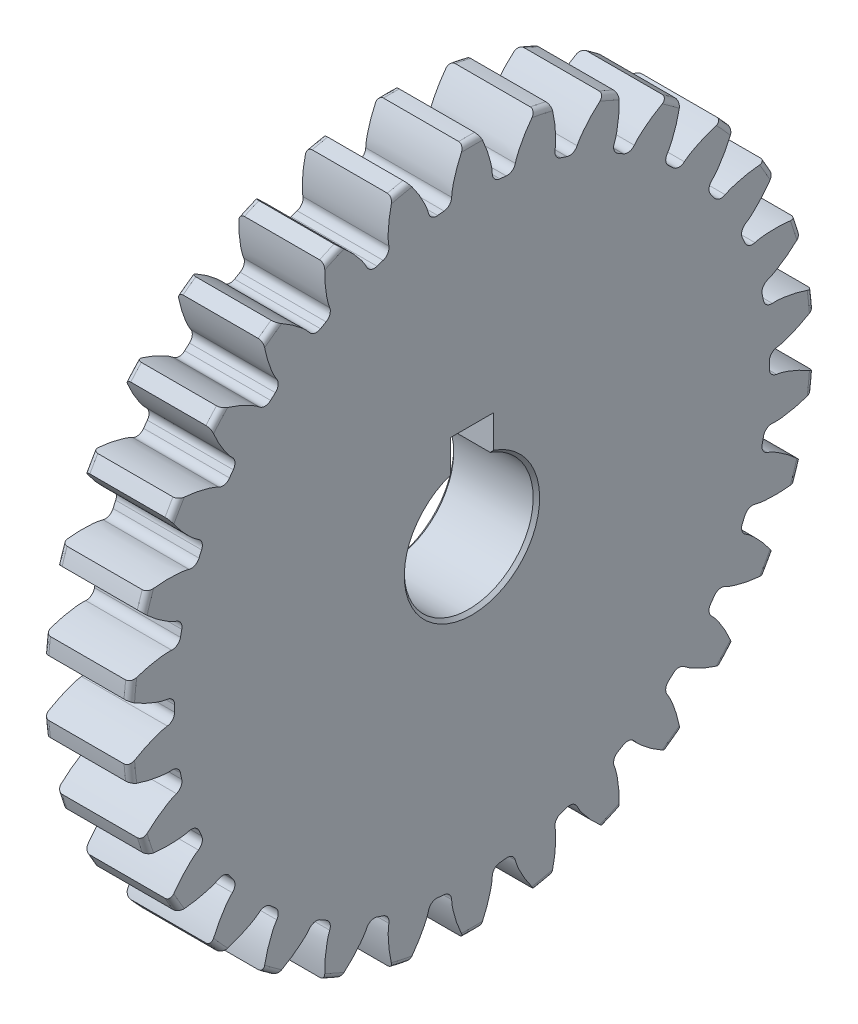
SolidWorks part; units mm, degrees
ref_plane "Front Plane" through (0, 0, 0) normal (0, 0, 1) x (1, 0, 0)
ref_plane "Top Plane" through (0, 0, 0) normal (0, 1, 0) x (1, 0, 0)
ref_plane "Right Plane" through (0, 0, 0) normal (1, 0, 0) x (0, 0, -1)
sketch "Sketch1" plane through (0, 0, 0) normal (0, 0, 1) x (1, 0, 0)
  line L0 (-4.5, 16) -> (-4.5, 0)
  line L1 (-4.5, 0) -> (4.5, 0)
  line L2 (4.5, 0) -> (4.5, 16)
  line L3 (4.5, 16) -> (-4.5, 16)
  line L4 (-4.5, 0) -> (4.5, 0) construction
revolve "Revolve1" add sketch "Sketch1" angle 360 about L4
sketch "Sketch2" plane through (-4.5, 0, 0) normal (-1, 0, 0) x (0, 0, 1)
  arc A0 (0.9541, 13.8101) -> (1.9381, 13.7067) centre (0, 0) cw
  arc A1 (2.9651, 15.7229) -> (0.3687, 15.9958) centre (0, 0) ccw
  spline S0 degree 3 poles (0.3687, 15.9958) (0.4111, 15.912) (0.4521, 15.8276) (0.4915, 15.7423) (0.5615, 15.5907) (0.6264, 15.4366) (0.6838, 15.2798) (0.7414, 15.123) (0.7918, 14.9633) (0.8344, 14.8018) (0.89, 14.5911) (0.9382, 14.3754) (0.9452, 14.1576) (0.949, 14.0418) (0.9511, 13.9259) (0.9541, 13.8101) knots -0.000282 -0.000282 -0.000282 -0.000282 0 0 0 0.000501 0.000501 0.000501 0.001002 0.001002 0.001002 0.001658 0.001658 0.001658 0.002003 0.002003 0.002003 0.002003
  spline S1 degree 3 poles (1.9381, 13.7067) (1.965, 13.8194) (1.9912, 13.9322) (2.019, 14.0447) (2.0592, 14.2078) (2.1235, 14.365) (2.1953, 14.5168) (2.2668, 14.6678) (2.3448, 14.8159) (2.4297, 14.9597) (2.5401, 15.1466) (2.6623, 15.3267) (2.7923, 15.5005) (2.8485, 15.5757) (2.9062, 15.6498) (2.9651, 15.7229) knots -0.000345 -0.000345 -0.000345 -0.000345 0 0 0 0.000504 0.000504 0.000504 0.001004 0.001004 0.001004 0.001654 0.001654 0.001654 0.001934 0.001934 0.001934 0.001934
extrude "Cut-Extrude1" cut sketch "Sketch2" against normal through all
sketch "Sketch3" plane through (-4.5, 0, 0) normal (-1, 0, 0) x (0, 0, 1)
  arc A0 (3.8045, 13.3099) -> (4.7455, 13.0042) centre (0, 0) cw
  arc A1 (6.1693, 14.7628) -> (3.6863, 15.5696) centre (0, 0) ccw
  spline S0 degree 3 poles (3.6863, 15.5696) (3.7104, 15.4788) (3.733, 15.3877) (3.7537, 15.2961) (3.7907, 15.1333) (3.8221, 14.969) (3.8457, 14.8037) (3.8694, 14.6384) (3.8856, 14.4717) (3.8937, 14.3049) (3.9042, 14.0872) (3.9065, 13.8662) (3.8681, 13.6517) (3.8477, 13.5376) (3.8257, 13.4239) (3.8045, 13.3099) knots -0.000282 -0.000282 -0.000282 -0.000282 0 0 0 0.000501 0.000501 0.000501 0.001002 0.001002 0.001002 0.001658 0.001658 0.001658 0.002003 0.002003 0.002003 0.002003
  spline S1 degree 3 poles (4.7455, 13.0042) (4.7953, 13.1088) (4.8444, 13.2138) (4.8949, 13.3181) (4.9682, 13.4692) (5.0637, 13.6096) (5.1656, 13.7432) (5.2668, 13.876) (5.374, 14.0046) (5.4869, 14.1276) (5.6337, 14.2875) (5.7907, 14.4382) (5.954, 14.5812) (6.0246, 14.6431) (6.0964, 14.7036) (6.1693, 14.7628) knots -0.000345 -0.000345 -0.000345 -0.000345 0 0 0 0.000504 0.000504 0.000504 0.001004 0.001004 0.001004 0.001654 0.001654 0.001654 0.001934 0.001934 0.001934 0.001934
extrude "Cut-Extrude2" cut sketch "Sketch3" against normal through all
sketch "Sketch4" plane through (-4.5, 0, 0) normal (-1, 0, 0) x (0, 0, 1)
  arc A0 (6.4886, 12.2281) -> (7.3455, 11.7334) centre (0, 0) cw
  arc A1 (9.1038, 13.1575) -> (6.8429, 14.4629) centre (0, 0) ccw
  spline S0 degree 3 poles (6.8429, 14.4629) (6.8476, 14.3691) (6.8507, 14.2753) (6.852, 14.1814) (6.8542, 14.0145) (6.8508, 13.8472) (6.8396, 13.6806) (6.8283, 13.514) (6.8095, 13.3476) (6.7827, 13.1828) (6.7478, 12.9677) (6.704, 12.751) (6.6219, 12.5492) (6.5782, 12.4418) (6.5331, 12.3351) (6.4886, 12.2281) knots -0.000282 -0.000282 -0.000282 -0.000282 0 0 0 0.000501 0.000501 0.000501 0.001002 0.001002 0.001002 0.001658 0.001658 0.001658 0.002003 0.002003 0.002003 0.002003
  spline S1 degree 3 poles (7.3455, 11.7334) (7.416, 11.8254) (7.4858, 11.9178) (7.5569, 12.0093) (7.66, 12.142) (7.7827, 12.2594) (7.9101, 12.3689) (8.0367, 12.4777) (8.1682, 12.5813) (8.3043, 12.6781) (8.4812, 12.8039) (8.6661, 12.9188) (8.8555, 13.0247) (8.9374, 13.0705) (9.0203, 13.1147) (9.1038, 13.1575) knots -0.000345 -0.000345 -0.000345 -0.000345 0 0 0 0.000504 0.000504 0.000504 0.001004 0.001004 0.001004 0.001654 0.001654 0.001654 0.001934 0.001934 0.001934 0.001934
extrude "Cut-Extrude3" cut sketch "Sketch4" against normal through all
sketch "Sketch5" plane through (-4.5, 0, 0) normal (-1, 0, 0) x (0, 0, 1)
  arc A0 (8.8892, 10.6118) -> (9.6245, 9.9498) centre (0, 0) cw
  arc A1 (11.6405, 10.9772) -> (9.7003, 12.7241) centre (0, 0) ccw
  spline S0 degree 3 poles (9.7003, 12.7241) (9.6854, 12.6315) (9.669, 12.539) (9.6507, 12.4469) (9.6182, 12.2831) (9.5801, 12.1203) (9.5345, 11.9597) (9.4888, 11.799) (9.4358, 11.6402) (9.3754, 11.4845) (9.2965, 11.2813) (9.2086, 11.0785) (9.0863, 10.8981) (9.0213, 10.8022) (8.9549, 10.7072) (8.8892, 10.6118) knots -0.000282 -0.000282 -0.000282 -0.000282 0 0 0 0.000501 0.000501 0.000501 0.001002 0.001002 0.001002 0.001658 0.001658 0.001658 0.002003 0.002003 0.002003 0.002003
  spline S1 degree 3 poles (9.6245, 9.9498) (9.7125, 10.0251) (9.8001, 10.101) (9.8887, 10.1757) (10.0171, 10.284) (10.1615, 10.3733) (10.3088, 10.454) (10.4554, 10.5341) (10.6055, 10.6081) (10.7588, 10.6745) (10.9579, 10.7608) (11.1627, 10.8347) (11.37, 10.8989) (11.4596, 10.9267) (11.5499, 10.9527) (11.6405, 10.9772) knots -0.000345 -0.000345 -0.000345 -0.000345 0 0 0 0.000504 0.000504 0.000504 0.001004 0.001004 0.001004 0.001654 0.001654 0.001654 0.001934 0.001934 0.001934 0.001934
extrude "Cut-Extrude4" cut sketch "Sketch5" against normal through all
sketch "Sketch6" plane through (-4.5, 0, 0) normal (-1, 0, 0) x (0, 0, 1)
  arc A0 (10.9013, 8.5317) -> (11.4829, 7.7313) centre (0, 0) cw
  arc A1 (13.6684, 8.3172) -> (12.1338, 10.4293) centre (0, 0) ccw
  spline S0 degree 3 poles (12.1338, 10.4293) (12.1, 10.3417) (12.0647, 10.2547) (12.0277, 10.1684) (11.9619, 10.015) (11.8907, 9.8636) (11.8127, 9.716) (11.7346, 9.5683) (11.6498, 9.424) (11.5582, 9.2843) (11.4389, 9.102) (11.3107, 8.9218) (11.1536, 8.7708) (11.0701, 8.6906) (10.9854, 8.6114) (10.9013, 8.5317) knots -0.000282 -0.000282 -0.000282 -0.000282 0 0 0 0.000501 0.000501 0.000501 0.001002 0.001002 0.001002 0.001658 0.001658 0.001658 0.002003 0.002003 0.002003 0.002003
  spline S1 degree 3 poles (11.4829, 7.7313) (11.5846, 7.7867) (11.6861, 7.8427) (11.7882, 7.8974) (11.9364, 7.9766) (12.0962, 8.034) (12.2571, 8.0822) (12.4171, 8.1301) (12.5793, 8.1712) (12.743, 8.2043) (12.9558, 8.2474) (13.1714, 8.2771) (13.3875, 8.2968) (13.481, 8.3053) (13.5747, 8.312) (13.6684, 8.3172) knots -0.000345 -0.000345 -0.000345 -0.000345 0 0 0 0.000504 0.000504 0.000504 0.001004 0.001004 0.001004 0.001654 0.001654 0.001654 0.001934 0.001934 0.001934 0.001934
extrude "Cut-Extrude5" cut sketch "Sketch6" against normal through all
sketch "Sketch7" plane through (-4.5, 0, 0) normal (-1, 0, 0) x (0, 0, 1)
  arc A0 (12.4369, 6.0788) -> (12.8394, 5.1749) centre (0, 0) cw
  arc A1 (15.0989, 5.2936) -> (14.0371, 7.6786) centre (0, 0) ccw
  spline S0 degree 3 poles (14.0371, 7.6786) (13.9858, 7.6) (13.9331, 7.5222) (13.879, 7.4455) (13.7827, 7.3091) (13.6816, 7.1758) (13.5746, 7.0477) (13.4675, 6.9195) (13.3545, 6.7959) (13.236, 6.6783) (13.0813, 6.5248) (12.9185, 6.3752) (12.7335, 6.2602) (12.635, 6.199) (12.5358, 6.1392) (12.4369, 6.0788) knots -0.000282 -0.000282 -0.000282 -0.000282 0 0 0 0.000501 0.000501 0.000501 0.001002 0.001002 0.001002 0.001658 0.001658 0.001658 0.002003 0.002003 0.002003 0.002003
  spline S1 degree 3 poles (12.8394, 5.1749) (12.9504, 5.2079) (13.0613, 5.2417) (13.1726, 5.2739) (13.3339, 5.3206) (13.5022, 5.3435) (13.6696, 5.3572) (13.8361, 5.3708) (14.0033, 5.3773) (14.1703, 5.3756) (14.3874, 5.3735) (14.6045, 5.3577) (14.82, 5.3321) (14.9132, 5.321) (15.0062, 5.3081) (15.0989, 5.2936) knots -0.000345 -0.000345 -0.000345 -0.000345 0 0 0 0.000504 0.000504 0.000504 0.001004 0.001004 0.001004 0.001654 0.001654 0.001654 0.001934 0.001934 0.001934 0.001934
extrude "Cut-Extrude6" cut sketch "Sketch7" against normal through all
sketch "Sketch8" plane through (-4.5, 0, 0) normal (-1, 0, 0) x (0, 0, 1)
  arc A0 (13.429, 3.3602) -> (13.6347, 2.3924) centre (0, 0) cw
  arc A1 (15.8696, 2.0387) -> (15.3268, 4.5923) centre (0, 0) ccw
  spline S0 degree 3 poles (15.3268, 4.5923) (15.2603, 4.5261) (15.1926, 4.461) (15.1237, 4.3972) (15.0012, 4.2838) (14.8746, 4.1745) (14.7433, 4.0713) (14.6119, 3.9682) (14.4757, 3.8709) (14.3352, 3.7804) (14.152, 3.6625) (13.9617, 3.55) (13.7568, 3.476) (13.6478, 3.4366) (13.5383, 3.3988) (13.429, 3.3602) knots -0.000282 -0.000282 -0.000282 -0.000282 0 0 0 0.000501 0.000501 0.000501 0.001002 0.001002 0.001002 0.001658 0.001658 0.001658 0.002003 0.002003 0.002003 0.002003
  spline S1 degree 3 poles (13.6347, 2.3924) (13.7502, 2.4016) (13.8657, 2.4115) (13.9812, 2.4199) (14.1488, 2.432) (14.3181, 2.4195) (14.4847, 2.3981) (14.6504, 2.3768) (14.8153, 2.3483) (14.9783, 2.312) (15.1902, 2.2648) (15.3993, 2.2042) (15.6047, 2.1343) (15.6936, 2.1041) (15.7819, 2.0721) (15.8696, 2.0387) knots -0.000345 -0.000345 -0.000345 -0.000345 0 0 0 0.000504 0.000504 0.000504 0.001004 0.001004 0.001004 0.001654 0.001654 0.001654 0.001934 0.001934 0.001934 0.001934
extrude "Cut-Extrude7" cut sketch "Sketch8" against normal through all
sketch "Sketch9" plane through (-4.5, 0, 0) normal (-1, 0, 0) x (0, 0, 1)
  arc A0 (13.8342, 0.4947) -> (13.8342, -0.4947) centre (0, 0) cw
  arc A1 (15.9467, -1.3054) -> (15.9467, 1.3054) centre (0, 0) ccw
  spline S0 degree 3 poles (15.9467, 1.3054) (15.8678, 1.2544) (15.7881, 1.2048) (15.7075, 1.1567) (15.564, 1.0713) (15.4175, 0.9906) (15.2676, 0.9171) (15.1176, 0.8435) (14.9641, 0.7766) (14.808, 0.7174) (14.6042, 0.6401) (14.3947, 0.5696) (14.1788, 0.5398) (14.0641, 0.524) (13.9491, 0.5097) (13.8342, 0.4947) knots -0.000282 -0.000282 -0.000282 -0.000282 0 0 0 0.000501 0.000501 0.000501 0.001002 0.001002 0.001002 0.001658 0.001658 0.001658 0.002003 0.002003 0.002003 0.002003
  spline S1 degree 3 poles (13.8342, -0.4947) (13.9491, -0.5097) (14.0641, -0.524) (14.1788, -0.5398) (14.3452, -0.5628) (14.5082, -0.6103) (14.6668, -0.6659) (14.8244, -0.7211) (14.9798, -0.7833) (15.1317, -0.8527) (15.3291, -0.9429) (15.521, -1.0457) (15.7075, -1.1567) (15.7881, -1.2048) (15.8678, -1.2544) (15.9467, -1.3054) knots -0.000345 -0.000345 -0.000345 -0.000345 0 0 0 0.000504 0.000504 0.000504 0.001004 0.001004 0.001004 0.001654 0.001654 0.001654 0.001934 0.001934 0.001934 0.001934
extrude "Cut-Extrude8" cut sketch "Sketch9" against normal through all
sketch "Sketch10" plane through (-4.5, 0, 0) normal (-1, 0, 0) x (0, 0, 1)
  arc A0 (13.6347, -2.3924) -> (13.429, -3.3602) centre (0, 0) cw
  arc A1 (15.3268, -4.5923) -> (15.8696, -2.0387) centre (0, 0) ccw
  spline S0 degree 3 poles (15.8696, -2.0387) (15.7819, -2.0721) (15.6936, -2.1041) (15.6047, -2.1343) (15.4466, -2.1881) (15.2865, -2.2365) (15.1246, -2.2773) (14.9626, -2.3181) (14.7986, -2.3516) (14.6335, -2.3771) (14.4182, -2.4103) (14.1986, -2.4357) (13.9812, -2.4199) (13.8657, -2.4115) (13.7502, -2.4016) (13.6347, -2.3924) knots -0.000282 -0.000282 -0.000282 -0.000282 0 0 0 0.000501 0.000501 0.000501 0.001002 0.001002 0.001002 0.001658 0.001658 0.001658 0.002003 0.002003 0.002003 0.002003
  spline S1 degree 3 poles (13.429, -3.3602) (13.5383, -3.3988) (13.6478, -3.4366) (13.7568, -3.476) (13.9148, -3.533) (14.0643, -3.6134) (14.2078, -3.7007) (14.3505, -3.7876) (14.4896, -3.8806) (14.6238, -3.9801) (14.7981, -4.1094) (14.9644, -4.2498) (15.1237, -4.3972) (15.1926, -4.461) (15.2603, -4.5261) (15.3268, -4.5923) knots -0.000345 -0.000345 -0.000345 -0.000345 0 0 0 0.000504 0.000504 0.000504 0.001004 0.001004 0.001004 0.001654 0.001654 0.001654 0.001934 0.001934 0.001934 0.001934
extrude "Cut-Extrude9" cut sketch "Sketch10" against normal through all
sketch "Sketch11" plane through (-4.5, 0, 0) normal (-1, 0, 0) x (0, 0, 1)
  arc A0 (12.8394, -5.1749) -> (12.4369, -6.0788) centre (0, 0) cw
  arc A1 (14.0371, -7.6786) -> (15.0989, -5.2936) centre (0, 0) ccw
  spline S0 degree 3 poles (15.0989, -5.2936) (15.0062, -5.3081) (14.9132, -5.321) (14.82, -5.3321) (14.6542, -5.3518) (14.4875, -5.3659) (14.3206, -5.3721) (14.1537, -5.3783) (13.9863, -5.377) (13.8195, -5.3676) (13.602, -5.3554) (13.3819, -5.3345) (13.1726, -5.2739) (13.0613, -5.2417) (12.9504, -5.2079) (12.8394, -5.1749) knots -0.000282 -0.000282 -0.000282 -0.000282 0 0 0 0.000501 0.000501 0.000501 0.001002 0.001002 0.001002 0.001658 0.001658 0.001658 0.002003 0.002003 0.002003 0.002003
  spline S1 degree 3 poles (12.4369, -6.0788) (12.5358, -6.1392) (12.635, -6.199) (12.7335, -6.2602) (12.8761, -6.3489) (13.0057, -6.4586) (13.1279, -6.5738) (13.2494, -6.6884) (13.3662, -6.8084) (13.4767, -6.9336) (13.6203, -7.0963) (13.7538, -7.2682) (13.879, -7.4455) (13.9331, -7.5222) (13.9858, -7.6) (14.0371, -7.6786) knots -0.000345 -0.000345 -0.000345 -0.000345 0 0 0 0.000504 0.000504 0.000504 0.001004 0.001004 0.001004 0.001654 0.001654 0.001654 0.001934 0.001934 0.001934 0.001934
extrude "Cut-Extrude10" cut sketch "Sketch11" against normal through all
sketch "Sketch12" plane through (-4.5, 0, 0) normal (-1, 0, 0) x (0, 0, 1)
  arc A0 (11.4829, -7.7313) -> (10.9013, -8.5317) centre (0, 0) cw
  arc A1 (12.1338, -10.4293) -> (13.6684, -8.3172) centre (0, 0) ccw
  spline S0 degree 3 poles (13.6684, -8.3172) (13.5747, -8.312) (13.481, -8.3053) (13.3875, -8.2968) (13.2212, -8.2816) (13.0553, -8.2607) (12.8908, -8.2321) (12.7262, -8.2035) (12.5627, -8.1674) (12.4015, -8.1235) (12.1913, -8.0663) (11.9804, -8.0002) (11.7882, -7.8974) (11.6861, -7.8427) (11.5846, -7.7867) (11.4829, -7.7313) knots -0.000282 -0.000282 -0.000282 -0.000282 0 0 0 0.000501 0.000501 0.000501 0.001002 0.001002 0.001002 0.001658 0.001658 0.001658 0.002003 0.002003 0.002003 0.002003
  spline S1 degree 3 poles (10.9013, -8.5317) (10.9854, -8.6114) (11.0701, -8.6906) (11.1536, -8.7708) (11.2747, -8.8872) (11.3787, -9.0215) (11.4743, -9.1596) (11.5693, -9.297) (11.6585, -9.4386) (11.7406, -9.5841) (11.8473, -9.7731) (11.9421, -9.969) (12.0277, -10.1684) (12.0647, -10.2547) (12.1, -10.3417) (12.1338, -10.4293) knots -0.000345 -0.000345 -0.000345 -0.000345 0 0 0 0.000504 0.000504 0.000504 0.001004 0.001004 0.001004 0.001654 0.001654 0.001654 0.001934 0.001934 0.001934 0.001934
extrude "Cut-Extrude11" cut sketch "Sketch12" against normal through all
sketch "Sketch13" plane through (-4.5, 0, 0) normal (-1, 0, 0) x (0, 0, 1)
  arc A0 (9.6245, -9.9498) -> (8.8892, -10.6118) centre (0, 0) cw
  arc A1 (9.7003, -12.7241) -> (11.6405, -10.9772) centre (0, 0) ccw
  spline S0 degree 3 poles (11.6405, -10.9772) (11.5499, -10.9527) (11.4596, -10.9267) (11.37, -10.8989) (11.2105, -10.8495) (11.0525, -10.7945) (10.8975, -10.7324) (10.7425, -10.6702) (10.5901, -10.6009) (10.4416, -10.5245) (10.2478, -10.4248) (10.0552, -10.3162) (9.8887, -10.1757) (9.8001, -10.101) (9.7125, -10.0251) (9.6245, -9.9498) knots -0.000282 -0.000282 -0.000282 -0.000282 0 0 0 0.000501 0.000501 0.000501 0.001002 0.001002 0.001002 0.001658 0.001658 0.001658 0.002003 0.002003 0.002003 0.002003
  spline S1 degree 3 poles (8.8892, -10.6118) (8.9549, -10.7072) (9.0213, -10.8022) (9.0863, -10.8981) (9.1806, -11.0372) (9.2544, -11.1901) (9.3191, -11.3451) (9.3835, -11.4992) (9.4414, -11.6563) (9.4914, -11.8156) (9.5564, -12.0227) (9.6085, -12.2341) (9.6507, -12.4469) (9.669, -12.539) (9.6854, -12.6315) (9.7003, -12.7241) knots -0.000345 -0.000345 -0.000345 -0.000345 0 0 0 0.000504 0.000504 0.000504 0.001004 0.001004 0.001004 0.001654 0.001654 0.001654 0.001934 0.001934 0.001934 0.001934
extrude "Cut-Extrude12" cut sketch "Sketch13" against normal through all
sketch "Sketch14" plane through (-4.5, 0, 0) normal (-1, 0, 0) x (0, 0, 1)
  arc A0 (7.3455, -11.7334) -> (6.4886, -12.2281) centre (0, 0) cw
  arc A1 (6.8429, -14.4629) -> (9.1038, -13.1575) centre (0, 0) ccw
  spline S0 degree 3 poles (9.1038, -13.1575) (9.0203, -13.1147) (8.9374, -13.0705) (8.8555, -13.0247) (8.7098, -12.9432) (8.5667, -12.8566) (8.428, -12.7636) (8.2893, -12.6705) (8.1546, -12.571) (8.0252, -12.4654) (7.8564, -12.3276) (7.6907, -12.1814) (7.5569, -12.0093) (7.4858, -11.9178) (7.416, -11.8254) (7.3455, -11.7334) knots -0.000282 -0.000282 -0.000282 -0.000282 0 0 0 0.000501 0.000501 0.000501 0.001002 0.001002 0.001002 0.001658 0.001658 0.001658 0.002003 0.002003 0.002003 0.002003
  spline S1 degree 3 poles (6.4886, -12.2281) (6.5331, -12.3351) (6.5782, -12.4418) (6.6219, -12.5492) (6.6852, -12.7047) (6.7256, -12.8697) (6.7567, -13.0347) (6.7877, -13.1989) (6.8116, -13.3645) (6.8274, -13.5308) (6.848, -13.7469) (6.8549, -13.9644) (6.852, -14.1814) (6.8507, -14.2753) (6.8476, -14.3691) (6.8429, -14.4629) knots -0.000345 -0.000345 -0.000345 -0.000345 0 0 0 0.000504 0.000504 0.000504 0.001004 0.001004 0.001004 0.001654 0.001654 0.001654 0.001934 0.001934 0.001934 0.001934
extrude "Cut-Extrude13" cut sketch "Sketch14" against normal through all
sketch "Sketch15" plane through (-4.5, 0, 0) normal (-1, 0, 0) x (0, 0, 1)
  arc A0 (4.7455, -13.0042) -> (3.8045, -13.3099) centre (0, 0) cw
  arc A1 (3.6863, -15.5696) -> (6.1693, -14.7628) centre (0, 0) ccw
  spline S0 degree 3 poles (6.1693, -14.7628) (6.0964, -14.7036) (6.0246, -14.6431) (5.954, -14.5812) (5.8284, -14.4712) (5.7064, -14.3568) (5.5901, -14.2369) (5.4738, -14.117) (5.3628, -13.9918) (5.2582, -13.8615) (5.1217, -13.6917) (4.9899, -13.5141) (4.8949, -13.3181) (4.8444, -13.2138) (4.7953, -13.1088) (4.7455, -13.0042) knots -0.000282 -0.000282 -0.000282 -0.000282 0 0 0 0.000501 0.000501 0.000501 0.001002 0.001002 0.001002 0.001658 0.001658 0.001658 0.002003 0.002003 0.002003 0.002003
  spline S1 degree 3 poles (3.8045, -13.3099) (3.8257, -13.4239) (3.8477, -13.5376) (3.8681, -13.6517) (3.8977, -13.8171) (3.9029, -13.9868) (3.899, -14.1547) (3.8951, -14.3217) (3.8841, -14.4887) (3.865, -14.6546) (3.8402, -14.8702) (3.8018, -15.0845) (3.7537, -15.2961) (3.733, -15.3877) (3.7104, -15.4788) (3.6863, -15.5696) knots -0.000345 -0.000345 -0.000345 -0.000345 0 0 0 0.000504 0.000504 0.000504 0.001004 0.001004 0.001004 0.001654 0.001654 0.001654 0.001934 0.001934 0.001934 0.001934
extrude "Cut-Extrude14" cut sketch "Sketch15" against normal through all
sketch "Sketch16" plane through (-4.5, 0, 0) normal (-1, 0, 0) x (0, 0, 1)
  arc A0 (1.9381, -13.7067) -> (0.9541, -13.8101) centre (0, 0) cw
  arc A1 (0.3687, -15.9958) -> (2.9651, -15.7229) centre (0, 0) ccw
  spline S0 degree 3 poles (2.9651, -15.7229) (2.9062, -15.6498) (2.8485, -15.5757) (2.7923, -15.5005) (2.6923, -15.3668) (2.5968, -15.2295) (2.5079, -15.0881) (2.4191, -14.9466) (2.3365, -14.801) (2.2613, -14.6519) (2.1631, -14.4573) (2.0712, -14.2563) (2.019, -14.0447) (1.9912, -13.9322) (1.965, -13.8194) (1.9381, -13.7067) knots -0.000282 -0.000282 -0.000282 -0.000282 0 0 0 0.000501 0.000501 0.000501 0.001002 0.001002 0.001002 0.001658 0.001658 0.001658 0.002003 0.002003 0.002003 0.002003
  spline S1 degree 3 poles (0.9541, -13.8101) (0.9511, -13.9259) (0.949, -14.0418) (0.9452, -14.1576) (0.9398, -14.3255) (0.9096, -14.4926) (0.8709, -14.656) (0.8324, -14.8186) (0.7868, -14.9796) (0.7337, -15.138) (0.6646, -15.3437) (0.5824, -15.5453) (0.4915, -15.7423) (0.4521, -15.8276) (0.4111, -15.912) (0.3687, -15.9958) knots -0.000345 -0.000345 -0.000345 -0.000345 0 0 0 0.000504 0.000504 0.000504 0.001004 0.001004 0.001004 0.001654 0.001654 0.001654 0.001934 0.001934 0.001934 0.001934
extrude "Cut-Extrude15" cut sketch "Sketch16" against normal through all
sketch "Sketch17" plane through (-4.5, 0, 0) normal (-1, 0, 0) x (0, 0, 1)
  arc A0 (-0.9541, -13.8101) -> (-1.9381, -13.7067) centre (0, 0) cw
  arc A1 (-2.9651, -15.7229) -> (-0.3687, -15.9958) centre (0, 0) ccw
  spline S0 degree 3 poles (-0.3687, -15.9958) (-0.4111, -15.912) (-0.4521, -15.8276) (-0.4915, -15.7423) (-0.5615, -15.5907) (-0.6264, -15.4366) (-0.6838, -15.2798) (-0.7414, -15.123) (-0.7918, -14.9633) (-0.8344, -14.8018) (-0.89, -14.5911) (-0.9382, -14.3754) (-0.9452, -14.1576) (-0.949, -14.0418) (-0.9511, -13.9259) (-0.9541, -13.8101) knots -0.000282 -0.000282 -0.000282 -0.000282 0 0 0 0.000501 0.000501 0.000501 0.001002 0.001002 0.001002 0.001658 0.001658 0.001658 0.002003 0.002003 0.002003 0.002003
  spline S1 degree 3 poles (-1.9381, -13.7067) (-1.965, -13.8194) (-1.9912, -13.9322) (-2.019, -14.0447) (-2.0592, -14.2078) (-2.1235, -14.365) (-2.1953, -14.5168) (-2.2668, -14.6678) (-2.3448, -14.8159) (-2.4297, -14.9597) (-2.5401, -15.1466) (-2.6623, -15.3267) (-2.7923, -15.5005) (-2.8485, -15.5757) (-2.9062, -15.6498) (-2.9651, -15.7229) knots -0.000345 -0.000345 -0.000345 -0.000345 0 0 0 0.000504 0.000504 0.000504 0.001004 0.001004 0.001004 0.001654 0.001654 0.001654 0.001934 0.001934 0.001934 0.001934
extrude "Cut-Extrude16" cut sketch "Sketch17" against normal through all
sketch "Sketch18" plane through (-4.5, 0, 0) normal (-1, 0, 0) x (0, 0, 1)
  arc A0 (-3.8045, -13.3099) -> (-4.7455, -13.0042) centre (0, 0) cw
  arc A1 (-6.1693, -14.7628) -> (-3.6863, -15.5696) centre (0, 0) ccw
  spline S0 degree 3 poles (-3.6863, -15.5696) (-3.7104, -15.4788) (-3.733, -15.3877) (-3.7537, -15.2961) (-3.7907, -15.1333) (-3.8221, -14.969) (-3.8457, -14.8037) (-3.8694, -14.6384) (-3.8856, -14.4717) (-3.8937, -14.3049) (-3.9042, -14.0872) (-3.9065, -13.8662) (-3.8681, -13.6517) (-3.8477, -13.5376) (-3.8257, -13.4239) (-3.8045, -13.3099) knots -0.000282 -0.000282 -0.000282 -0.000282 0 0 0 0.000501 0.000501 0.000501 0.001002 0.001002 0.001002 0.001658 0.001658 0.001658 0.002003 0.002003 0.002003 0.002003
  spline S1 degree 3 poles (-4.7455, -13.0042) (-4.7953, -13.1088) (-4.8444, -13.2138) (-4.8949, -13.3181) (-4.9682, -13.4692) (-5.0637, -13.6096) (-5.1656, -13.7432) (-5.2668, -13.876) (-5.374, -14.0046) (-5.4869, -14.1276) (-5.6337, -14.2875) (-5.7907, -14.4382) (-5.954, -14.5812) (-6.0246, -14.6431) (-6.0964, -14.7036) (-6.1693, -14.7628) knots -0.000345 -0.000345 -0.000345 -0.000345 0 0 0 0.000504 0.000504 0.000504 0.001004 0.001004 0.001004 0.001654 0.001654 0.001654 0.001934 0.001934 0.001934 0.001934
extrude "Cut-Extrude17" cut sketch "Sketch18" against normal through all
sketch "Sketch19" plane through (-4.5, 0, 0) normal (-1, 0, 0) x (0, 0, 1)
  arc A0 (-6.4886, -12.2281) -> (-7.3455, -11.7334) centre (0, 0) cw
  arc A1 (-9.1038, -13.1575) -> (-6.8429, -14.4629) centre (0, 0) ccw
  spline S0 degree 3 poles (-6.8429, -14.4629) (-6.8476, -14.3691) (-6.8507, -14.2753) (-6.852, -14.1814) (-6.8542, -14.0145) (-6.8508, -13.8472) (-6.8396, -13.6806) (-6.8283, -13.514) (-6.8095, -13.3476) (-6.7827, -13.1828) (-6.7478, -12.9677) (-6.704, -12.751) (-6.6219, -12.5492) (-6.5782, -12.4418) (-6.5331, -12.3351) (-6.4886, -12.2281) knots -0.000282 -0.000282 -0.000282 -0.000282 0 0 0 0.000501 0.000501 0.000501 0.001002 0.001002 0.001002 0.001658 0.001658 0.001658 0.002003 0.002003 0.002003 0.002003
  spline S1 degree 3 poles (-7.3455, -11.7334) (-7.416, -11.8254) (-7.4858, -11.9178) (-7.5569, -12.0093) (-7.66, -12.142) (-7.7827, -12.2594) (-7.9101, -12.3689) (-8.0367, -12.4777) (-8.1682, -12.5813) (-8.3043, -12.6781) (-8.4812, -12.8039) (-8.6661, -12.9188) (-8.8555, -13.0247) (-8.9374, -13.0705) (-9.0203, -13.1147) (-9.1038, -13.1575) knots -0.000345 -0.000345 -0.000345 -0.000345 0 0 0 0.000504 0.000504 0.000504 0.001004 0.001004 0.001004 0.001654 0.001654 0.001654 0.001934 0.001934 0.001934 0.001934
extrude "Cut-Extrude18" cut sketch "Sketch19" against normal through all
sketch "Sketch20" plane through (-4.5, 0, 0) normal (-1, 0, 0) x (0, 0, 1)
  arc A0 (-8.8892, -10.6118) -> (-9.6245, -9.9498) centre (0, 0) cw
  arc A1 (-11.6405, -10.9772) -> (-9.7003, -12.7241) centre (0, 0) ccw
  spline S0 degree 3 poles (-9.7003, -12.7241) (-9.6854, -12.6315) (-9.669, -12.539) (-9.6507, -12.4469) (-9.6182, -12.2831) (-9.5801, -12.1203) (-9.5345, -11.9597) (-9.4888, -11.799) (-9.4358, -11.6402) (-9.3754, -11.4845) (-9.2965, -11.2813) (-9.2086, -11.0785) (-9.0863, -10.8981) (-9.0213, -10.8022) (-8.9549, -10.7072) (-8.8892, -10.6118) knots -0.000282 -0.000282 -0.000282 -0.000282 0 0 0 0.000501 0.000501 0.000501 0.001002 0.001002 0.001002 0.001658 0.001658 0.001658 0.002003 0.002003 0.002003 0.002003
  spline S1 degree 3 poles (-9.6245, -9.9498) (-9.7125, -10.0251) (-9.8001, -10.101) (-9.8887, -10.1757) (-10.0171, -10.284) (-10.1615, -10.3733) (-10.3088, -10.454) (-10.4554, -10.5341) (-10.6055, -10.6081) (-10.7588, -10.6745) (-10.9579, -10.7608) (-11.1627, -10.8347) (-11.37, -10.8989) (-11.4596, -10.9267) (-11.5499, -10.9527) (-11.6405, -10.9772) knots -0.000345 -0.000345 -0.000345 -0.000345 0 0 0 0.000504 0.000504 0.000504 0.001004 0.001004 0.001004 0.001654 0.001654 0.001654 0.001934 0.001934 0.001934 0.001934
extrude "Cut-Extrude19" cut sketch "Sketch20" against normal through all
sketch "Sketch21" plane through (-4.5, 0, 0) normal (-1, 0, 0) x (0, 0, 1)
  arc A0 (-10.9013, -8.5317) -> (-11.4829, -7.7313) centre (0, 0) cw
  arc A1 (-13.6684, -8.3172) -> (-12.1338, -10.4293) centre (0, 0) ccw
  spline S0 degree 3 poles (-12.1338, -10.4293) (-12.1, -10.3417) (-12.0647, -10.2547) (-12.0277, -10.1684) (-11.9619, -10.015) (-11.8907, -9.8636) (-11.8127, -9.716) (-11.7346, -9.5683) (-11.6498, -9.424) (-11.5582, -9.2843) (-11.4389, -9.102) (-11.3107, -8.9218) (-11.1536, -8.7708) (-11.0701, -8.6906) (-10.9854, -8.6114) (-10.9013, -8.5317) knots -0.000282 -0.000282 -0.000282 -0.000282 0 0 0 0.000501 0.000501 0.000501 0.001002 0.001002 0.001002 0.001658 0.001658 0.001658 0.002003 0.002003 0.002003 0.002003
  spline S1 degree 3 poles (-11.4829, -7.7313) (-11.5846, -7.7867) (-11.6861, -7.8427) (-11.7882, -7.8974) (-11.9364, -7.9766) (-12.0962, -8.034) (-12.2571, -8.0822) (-12.4171, -8.1301) (-12.5793, -8.1712) (-12.743, -8.2043) (-12.9558, -8.2474) (-13.1714, -8.2771) (-13.3875, -8.2968) (-13.481, -8.3053) (-13.5747, -8.312) (-13.6684, -8.3172) knots -0.000345 -0.000345 -0.000345 -0.000345 0 0 0 0.000504 0.000504 0.000504 0.001004 0.001004 0.001004 0.001654 0.001654 0.001654 0.001934 0.001934 0.001934 0.001934
extrude "Cut-Extrude20" cut sketch "Sketch21" against normal through all
sketch "Sketch22" plane through (-4.5, 0, 0) normal (-1, 0, 0) x (0, 0, 1)
  arc A0 (-12.4369, -6.0788) -> (-12.8394, -5.1749) centre (0, 0) cw
  arc A1 (-15.0989, -5.2936) -> (-14.0371, -7.6786) centre (0, 0) ccw
  spline S0 degree 3 poles (-14.0371, -7.6786) (-13.9858, -7.6) (-13.9331, -7.5222) (-13.879, -7.4455) (-13.7827, -7.3091) (-13.6816, -7.1758) (-13.5746, -7.0477) (-13.4675, -6.9195) (-13.3545, -6.7959) (-13.236, -6.6783) (-13.0813, -6.5248) (-12.9185, -6.3752) (-12.7335, -6.2602) (-12.635, -6.199) (-12.5358, -6.1392) (-12.4369, -6.0788) knots -0.000282 -0.000282 -0.000282 -0.000282 0 0 0 0.000501 0.000501 0.000501 0.001002 0.001002 0.001002 0.001658 0.001658 0.001658 0.002003 0.002003 0.002003 0.002003
  spline S1 degree 3 poles (-12.8394, -5.1749) (-12.9504, -5.2079) (-13.0613, -5.2417) (-13.1726, -5.2739) (-13.3339, -5.3206) (-13.5022, -5.3435) (-13.6696, -5.3572) (-13.8361, -5.3708) (-14.0033, -5.3773) (-14.1703, -5.3756) (-14.3874, -5.3735) (-14.6045, -5.3577) (-14.82, -5.3321) (-14.9132, -5.321) (-15.0062, -5.3081) (-15.0989, -5.2936) knots -0.000345 -0.000345 -0.000345 -0.000345 0 0 0 0.000504 0.000504 0.000504 0.001004 0.001004 0.001004 0.001654 0.001654 0.001654 0.001934 0.001934 0.001934 0.001934
extrude "Cut-Extrude21" cut sketch "Sketch22" against normal through all
sketch "Sketch23" plane through (-4.5, 0, 0) normal (-1, 0, 0) x (0, 0, 1)
  arc A0 (-13.429, -3.3602) -> (-13.6347, -2.3924) centre (0, 0) cw
  arc A1 (-15.8696, -2.0387) -> (-15.3268, -4.5923) centre (0, 0) ccw
  spline S0 degree 3 poles (-15.3268, -4.5923) (-15.2603, -4.5261) (-15.1926, -4.461) (-15.1237, -4.3972) (-15.0012, -4.2838) (-14.8746, -4.1745) (-14.7433, -4.0713) (-14.6119, -3.9682) (-14.4757, -3.8709) (-14.3352, -3.7804) (-14.152, -3.6625) (-13.9617, -3.55) (-13.7568, -3.476) (-13.6478, -3.4366) (-13.5383, -3.3988) (-13.429, -3.3602) knots -0.000282 -0.000282 -0.000282 -0.000282 0 0 0 0.000501 0.000501 0.000501 0.001002 0.001002 0.001002 0.001658 0.001658 0.001658 0.002003 0.002003 0.002003 0.002003
  spline S1 degree 3 poles (-13.6347, -2.3924) (-13.7502, -2.4016) (-13.8657, -2.4115) (-13.9812, -2.4199) (-14.1488, -2.432) (-14.3181, -2.4195) (-14.4847, -2.3981) (-14.6504, -2.3768) (-14.8153, -2.3483) (-14.9783, -2.312) (-15.1902, -2.2648) (-15.3993, -2.2042) (-15.6047, -2.1343) (-15.6936, -2.1041) (-15.7819, -2.0721) (-15.8696, -2.0387) knots -0.000345 -0.000345 -0.000345 -0.000345 0 0 0 0.000504 0.000504 0.000504 0.001004 0.001004 0.001004 0.001654 0.001654 0.001654 0.001934 0.001934 0.001934 0.001934
extrude "Cut-Extrude22" cut sketch "Sketch23" against normal through all
sketch "Sketch24" plane through (-4.5, 0, 0) normal (-1, 0, 0) x (0, 0, 1)
  arc A0 (-15.9467, 1.3054) -> (-15.9467, -1.3054) centre (0, 0) ccw
  arc A1 (-13.8342, -0.4947) -> (-13.8342, 0.4947) centre (0, 0) cw
  spline S0 degree 3 poles (-15.9467, -1.3054) (-15.8678, -1.2544) (-15.7881, -1.2048) (-15.7075, -1.1567) (-15.564, -1.0713) (-15.4175, -0.9906) (-15.2676, -0.9171) (-15.1176, -0.8435) (-14.9641, -0.7766) (-14.808, -0.7174) (-14.6042, -0.6401) (-14.3947, -0.5696) (-14.1788, -0.5398) (-14.0641, -0.524) (-13.9491, -0.5097) (-13.8342, -0.4947) knots -0.000282 -0.000282 -0.000282 -0.000282 0 0 0 0.000501 0.000501 0.000501 0.001002 0.001002 0.001002 0.001658 0.001658 0.001658 0.002003 0.002003 0.002003 0.002003
  spline S1 degree 3 poles (-13.8342, 0.4947) (-13.9491, 0.5097) (-14.0641, 0.524) (-14.1788, 0.5398) (-14.3452, 0.5628) (-14.5082, 0.6103) (-14.6668, 0.6659) (-14.8244, 0.7211) (-14.9798, 0.7833) (-15.1317, 0.8527) (-15.3291, 0.9429) (-15.521, 1.0457) (-15.7075, 1.1567) (-15.7881, 1.2048) (-15.8678, 1.2544) (-15.9467, 1.3054) knots -0.000345 -0.000345 -0.000345 -0.000345 0 0 0 0.000504 0.000504 0.000504 0.001004 0.001004 0.001004 0.001654 0.001654 0.001654 0.001934 0.001934 0.001934 0.001934
extrude "Cut-Extrude23" cut sketch "Sketch24" against normal through all
sketch "Sketch25" plane through (-4.5, 0, 0) normal (-1, 0, 0) x (0, 0, 1)
  arc A0 (-15.3268, 4.5923) -> (-15.8696, 2.0387) centre (0, 0) ccw
  arc A1 (-13.6347, 2.3924) -> (-13.429, 3.3602) centre (0, 0) cw
  spline S0 degree 3 poles (-15.8696, 2.0387) (-15.7819, 2.0721) (-15.6936, 2.1041) (-15.6047, 2.1343) (-15.4466, 2.1881) (-15.2865, 2.2365) (-15.1246, 2.2773) (-14.9626, 2.3181) (-14.7986, 2.3516) (-14.6335, 2.3771) (-14.4182, 2.4103) (-14.1986, 2.4357) (-13.9812, 2.4199) (-13.8657, 2.4115) (-13.7502, 2.4016) (-13.6347, 2.3924) knots -0.000282 -0.000282 -0.000282 -0.000282 0 0 0 0.000501 0.000501 0.000501 0.001002 0.001002 0.001002 0.001658 0.001658 0.001658 0.002003 0.002003 0.002003 0.002003
  spline S1 degree 3 poles (-13.429, 3.3602) (-13.5383, 3.3988) (-13.6478, 3.4366) (-13.7568, 3.476) (-13.9148, 3.533) (-14.0643, 3.6134) (-14.2078, 3.7007) (-14.3505, 3.7876) (-14.4896, 3.8806) (-14.6238, 3.9801) (-14.7981, 4.1094) (-14.9644, 4.2498) (-15.1237, 4.3972) (-15.1926, 4.461) (-15.2603, 4.5261) (-15.3268, 4.5923) knots -0.000345 -0.000345 -0.000345 -0.000345 0 0 0 0.000504 0.000504 0.000504 0.001004 0.001004 0.001004 0.001654 0.001654 0.001654 0.001934 0.001934 0.001934 0.001934
extrude "Cut-Extrude24" cut sketch "Sketch25" against normal through all
sketch "Sketch26" plane through (-4.5, 0, 0) normal (-1, 0, 0) x (0, 0, 1)
  arc A0 (-14.0371, 7.6786) -> (-15.0989, 5.2936) centre (0, 0) ccw
  arc A1 (-12.8394, 5.1749) -> (-12.4369, 6.0788) centre (0, 0) cw
  spline S0 degree 3 poles (-15.0989, 5.2936) (-15.0062, 5.3081) (-14.9132, 5.321) (-14.82, 5.3321) (-14.6542, 5.3518) (-14.4875, 5.3659) (-14.3206, 5.3721) (-14.1537, 5.3783) (-13.9863, 5.377) (-13.8195, 5.3676) (-13.602, 5.3554) (-13.3819, 5.3345) (-13.1726, 5.2739) (-13.0613, 5.2417) (-12.9504, 5.2079) (-12.8394, 5.1749) knots -0.000282 -0.000282 -0.000282 -0.000282 0 0 0 0.000501 0.000501 0.000501 0.001002 0.001002 0.001002 0.001658 0.001658 0.001658 0.002003 0.002003 0.002003 0.002003
  spline S1 degree 3 poles (-12.4369, 6.0788) (-12.5358, 6.1392) (-12.635, 6.199) (-12.7335, 6.2602) (-12.8761, 6.3489) (-13.0057, 6.4586) (-13.1279, 6.5738) (-13.2494, 6.6884) (-13.3662, 6.8084) (-13.4767, 6.9336) (-13.6203, 7.0963) (-13.7538, 7.2682) (-13.879, 7.4455) (-13.9331, 7.5222) (-13.9858, 7.6) (-14.0371, 7.6786) knots -0.000345 -0.000345 -0.000345 -0.000345 0 0 0 0.000504 0.000504 0.000504 0.001004 0.001004 0.001004 0.001654 0.001654 0.001654 0.001934 0.001934 0.001934 0.001934
extrude "Cut-Extrude25" cut sketch "Sketch26" against normal through all
sketch "Sketch27" plane through (-4.5, 0, 0) normal (-1, 0, 0) x (0, 0, 1)
  arc A0 (-12.1338, 10.4293) -> (-13.6684, 8.3172) centre (0, 0) ccw
  arc A1 (-11.4829, 7.7313) -> (-10.9013, 8.5317) centre (0, 0) cw
  spline S0 degree 3 poles (-13.6684, 8.3172) (-13.5747, 8.312) (-13.481, 8.3053) (-13.3875, 8.2968) (-13.2212, 8.2816) (-13.0553, 8.2607) (-12.8908, 8.2321) (-12.7262, 8.2035) (-12.5627, 8.1674) (-12.4015, 8.1235) (-12.1913, 8.0663) (-11.9804, 8.0002) (-11.7882, 7.8974) (-11.6861, 7.8427) (-11.5846, 7.7867) (-11.4829, 7.7313) knots -0.000282 -0.000282 -0.000282 -0.000282 0 0 0 0.000501 0.000501 0.000501 0.001002 0.001002 0.001002 0.001658 0.001658 0.001658 0.002003 0.002003 0.002003 0.002003
  spline S1 degree 3 poles (-10.9013, 8.5317) (-10.9854, 8.6114) (-11.0701, 8.6906) (-11.1536, 8.7708) (-11.2747, 8.8872) (-11.3787, 9.0215) (-11.4743, 9.1596) (-11.5693, 9.297) (-11.6585, 9.4386) (-11.7406, 9.5841) (-11.8473, 9.7731) (-11.9421, 9.969) (-12.0277, 10.1684) (-12.0647, 10.2547) (-12.1, 10.3417) (-12.1338, 10.4293) knots -0.000345 -0.000345 -0.000345 -0.000345 0 0 0 0.000504 0.000504 0.000504 0.001004 0.001004 0.001004 0.001654 0.001654 0.001654 0.001934 0.001934 0.001934 0.001934
extrude "Cut-Extrude26" cut sketch "Sketch27" against normal through all
sketch "Sketch28" plane through (-4.5, 0, 0) normal (-1, 0, 0) x (0, 0, 1)
  arc A0 (-9.7003, 12.7241) -> (-11.6405, 10.9772) centre (0, 0) ccw
  arc A1 (-9.6245, 9.9498) -> (-8.8892, 10.6118) centre (0, 0) cw
  spline S0 degree 3 poles (-11.6405, 10.9772) (-11.5499, 10.9527) (-11.4596, 10.9267) (-11.37, 10.8989) (-11.2105, 10.8495) (-11.0525, 10.7945) (-10.8975, 10.7324) (-10.7425, 10.6702) (-10.5901, 10.6009) (-10.4416, 10.5245) (-10.2478, 10.4248) (-10.0552, 10.3162) (-9.8887, 10.1757) (-9.8001, 10.101) (-9.7125, 10.0251) (-9.6245, 9.9498) knots -0.000282 -0.000282 -0.000282 -0.000282 0 0 0 0.000501 0.000501 0.000501 0.001002 0.001002 0.001002 0.001658 0.001658 0.001658 0.002003 0.002003 0.002003 0.002003
  spline S1 degree 3 poles (-8.8892, 10.6118) (-8.9549, 10.7072) (-9.0213, 10.8022) (-9.0863, 10.8981) (-9.1806, 11.0372) (-9.2544, 11.1901) (-9.3191, 11.3451) (-9.3835, 11.4992) (-9.4414, 11.6563) (-9.4914, 11.8156) (-9.5564, 12.0227) (-9.6085, 12.2341) (-9.6507, 12.4469) (-9.669, 12.539) (-9.6854, 12.6315) (-9.7003, 12.7241) knots -0.000345 -0.000345 -0.000345 -0.000345 0 0 0 0.000504 0.000504 0.000504 0.001004 0.001004 0.001004 0.001654 0.001654 0.001654 0.001934 0.001934 0.001934 0.001934
extrude "Cut-Extrude27" cut sketch "Sketch28" against normal through all
sketch "Sketch29" plane through (-4.5, 0, 0) normal (-1, 0, 0) x (0, 0, 1)
  arc A0 (-6.8429, 14.4629) -> (-9.1038, 13.1575) centre (0, 0) ccw
  arc A1 (-7.3455, 11.7334) -> (-6.4886, 12.2281) centre (0, 0) cw
  spline S0 degree 3 poles (-9.1038, 13.1575) (-9.0203, 13.1147) (-8.9374, 13.0705) (-8.8555, 13.0247) (-8.7098, 12.9432) (-8.5667, 12.8566) (-8.428, 12.7636) (-8.2893, 12.6705) (-8.1546, 12.571) (-8.0252, 12.4654) (-7.8564, 12.3276) (-7.6907, 12.1814) (-7.5569, 12.0093) (-7.4858, 11.9178) (-7.416, 11.8254) (-7.3455, 11.7334) knots -0.000282 -0.000282 -0.000282 -0.000282 0 0 0 0.000501 0.000501 0.000501 0.001002 0.001002 0.001002 0.001658 0.001658 0.001658 0.002003 0.002003 0.002003 0.002003
  spline S1 degree 3 poles (-6.4886, 12.2281) (-6.5331, 12.3351) (-6.5782, 12.4418) (-6.6219, 12.5492) (-6.6852, 12.7047) (-6.7256, 12.8697) (-6.7567, 13.0347) (-6.7877, 13.1989) (-6.8116, 13.3645) (-6.8274, 13.5308) (-6.848, 13.7469) (-6.8549, 13.9644) (-6.852, 14.1814) (-6.8507, 14.2753) (-6.8476, 14.3691) (-6.8429, 14.4629) knots -0.000345 -0.000345 -0.000345 -0.000345 0 0 0 0.000504 0.000504 0.000504 0.001004 0.001004 0.001004 0.001654 0.001654 0.001654 0.001934 0.001934 0.001934 0.001934
extrude "Cut-Extrude28" cut sketch "Sketch29" against normal through all
sketch "Sketch30" plane through (-4.5, 0, 0) normal (-1, 0, 0) x (0, 0, 1)
  arc A0 (-3.6863, 15.5696) -> (-6.1693, 14.7628) centre (0, 0) ccw
  arc A1 (-4.7455, 13.0042) -> (-3.8045, 13.3099) centre (0, 0) cw
  spline S0 degree 3 poles (-6.1693, 14.7628) (-6.0964, 14.7036) (-6.0246, 14.6431) (-5.954, 14.5812) (-5.8284, 14.4712) (-5.7064, 14.3568) (-5.5901, 14.2369) (-5.4738, 14.117) (-5.3628, 13.9918) (-5.2582, 13.8615) (-5.1217, 13.6917) (-4.9899, 13.5141) (-4.8949, 13.3181) (-4.8444, 13.2138) (-4.7953, 13.1088) (-4.7455, 13.0042) knots -0.000282 -0.000282 -0.000282 -0.000282 0 0 0 0.000501 0.000501 0.000501 0.001002 0.001002 0.001002 0.001658 0.001658 0.001658 0.002003 0.002003 0.002003 0.002003
  spline S1 degree 3 poles (-3.8045, 13.3099) (-3.8257, 13.4239) (-3.8477, 13.5376) (-3.8681, 13.6517) (-3.8977, 13.8171) (-3.9029, 13.9868) (-3.899, 14.1547) (-3.8951, 14.3217) (-3.8841, 14.4887) (-3.865, 14.6546) (-3.8402, 14.8702) (-3.8018, 15.0845) (-3.7537, 15.2961) (-3.733, 15.3877) (-3.7104, 15.4788) (-3.6863, 15.5696) knots -0.000345 -0.000345 -0.000345 -0.000345 0 0 0 0.000504 0.000504 0.000504 0.001004 0.001004 0.001004 0.001654 0.001654 0.001654 0.001934 0.001934 0.001934 0.001934
extrude "Cut-Extrude29" cut sketch "Sketch30" against normal through all
sketch "Sketch31" plane through (-4.5, 0, 0) normal (-1, 0, 0) x (0, 0, 1)
  arc A0 (-0.3687, 15.9958) -> (-2.9651, 15.7229) centre (0, 0) ccw
  arc A1 (-1.9381, 13.7067) -> (-0.9541, 13.8101) centre (0, 0) cw
  spline S0 degree 3 poles (-2.9651, 15.7229) (-2.9062, 15.6498) (-2.8485, 15.5757) (-2.7923, 15.5005) (-2.6923, 15.3668) (-2.5968, 15.2295) (-2.5079, 15.0881) (-2.4191, 14.9466) (-2.3365, 14.801) (-2.2613, 14.6519) (-2.1631, 14.4573) (-2.0712, 14.2563) (-2.019, 14.0447) (-1.9912, 13.9322) (-1.965, 13.8194) (-1.9381, 13.7067) knots -0.000282 -0.000282 -0.000282 -0.000282 0 0 0 0.000501 0.000501 0.000501 0.001002 0.001002 0.001002 0.001658 0.001658 0.001658 0.002003 0.002003 0.002003 0.002003
  spline S1 degree 3 poles (-0.9541, 13.8101) (-0.9511, 13.9259) (-0.949, 14.0418) (-0.9452, 14.1576) (-0.9398, 14.3255) (-0.9096, 14.4926) (-0.8709, 14.656) (-0.8324, 14.8186) (-0.7868, 14.9796) (-0.7337, 15.138) (-0.6646, 15.3437) (-0.5824, 15.5453) (-0.4915, 15.7423) (-0.4521, 15.8276) (-0.4111, 15.912) (-0.3687, 15.9958) knots -0.000345 -0.000345 -0.000345 -0.000345 0 0 0 0.000504 0.000504 0.000504 0.001004 0.001004 0.001004 0.001654 0.001654 0.001654 0.001934 0.001934 0.001934 0.001934
extrude "Cut-Extrude30" cut sketch "Sketch31" against normal through all
ref_plane "Plane4" through (0, 0, 0) normal (0, 0, -1) x (-1, 0, 0)
fillet "Fillet2" radius 0.39 60 edges at (0, -0.4947, -13.8342) (0, 9.9498, -9.6245) (0, 5.1749, -12.8394) (0, -13.8101, 0.9541) (0, 13.0042, -4.7455) (0, -13.7067, 1.9381) (0, 2.3924, -13.6347) (0, -13.8101, -0.9541) (0, 7.7313, -11.4829) (0, -13.7067, -1.9381) (0, 11.7334, -7.3455) (0, -13.3099, 3.8045) (0, 13.8101, -0.9541) (0, -13.0042, 4.7455) (0, 2.3924, 13.6347) (0, -13.3099, -3.8045) (0, 5.1749, 12.8394) (0, -13.0042, -4.7455) (0, 7.7313, 11.4829) (0, -12.2281, 6.4886) (0, 9.9498, 9.6245) (0, -11.7334, 7.3455) (0, 11.7334, 7.3455) (0, -12.2281, -6.4886) (0, 13.0042, 4.7455) (0, -11.7334, -7.3455) (0, 13.7067, 1.9381) (0, -10.6118, 8.8892) (0, 0.4947, 13.8342) (0, -9.9498, 9.6245) (0, 0.4947, -13.8342) (0, -10.6118, -8.8892) (0, 3.3602, 13.429) (0, -9.9498, -9.6245) (0, 3.3602, -13.429) (0, -8.5317, 10.9013) (0, 6.0788, 12.4369) (0, -7.7313, 11.4829) (0, 6.0788, -12.4369) (0, -8.5317, -10.9013) (0, 8.5317, 10.9013) (0, -7.7313, -11.4829) (0, 8.5317, -10.9013) (0, -6.0788, 12.4369) (0, 10.6118, 8.8892) (0, -5.1749, 12.8394) (0, 10.6118, -8.8892) (0, -6.0788, -12.4369) (0, 12.2281, 6.4886) (0, -5.1749, -12.8394) (0, 12.2281, -6.4886) (0, -3.3602, 13.429) (0, 13.3099, 3.8045) (0, -2.3924, 13.6347) (0, 13.3099, -3.8045) (0, -3.3602, -13.429) (0, 13.8101, 0.9541) (0, -2.3924, -13.6347) (0, -0.4947, 13.8342) (0, 13.7067, -1.9381)
sketch "Sketch40" plane through (0, 0, 0) normal (0, 1, 0) x (1, 0, 0)
  line L0 (-4.5, 15.0989) -> (-4.5, 13.1726) construction
  line L1 (-8.4464, 17.2217) -> (-2.5, 17.2217)
  line L2 (-8.4464, 17.2217) -> (-8.4464, -17.5419)
  line L3 (-8.4464, -17.5419) -> (-2.5, -17.5419)
  line L4 (-2.5, 17.2217) -> (-2.5, -17.5419)
  line L5 (2.5, -17.5419) -> (8.7666, -17.5419)
  line L6 (2.5, -17.5419) -> (2.5, 17.2217)
  line L7 (2.5, 17.2217) -> (8.7666, 17.2217)
  line L8 (8.7666, -17.5419) -> (8.7666, 17.2217)
  line L9 (4.5, 13.1726) -> (4.5, 15.0989) construction
  dimension "D1" = 2
  dimension "D2" = 2
extrude "Cut-Extrude31" cut sketch "Sketch40" against normal mid plane 40
hole_wizard "Ø4.0 (4) Diameter Hole1" positions "Sketch42" profile "Sketch41" hole size "Ø4.0" standard "ANSI Metric"
sketch "Sketch42" plane through (-2.5, 0, 0) normal (-1, 0, 0) x (0, 0, 1)
  point P0 (0, 0)
sketch "Sketch41" plane through (-2.5, 0, 0) normal (0, 1, 0) x (0, 0, 1)
  line L0 (0, 0) -> (0, 5)
  line L1 (0, 5) -> (3, 5)
  line L2 (3, 5) -> (3, 0)
  line L5 (3, 0) -> (0, 0)
  line L11 (0, -6.35) -> (0, 107.95) construction
  dimension "Thru Hole Dia." = 6
  dimension "Thru Hole Depth" = 5
sketch "Sketch43" plane through (2.5, 0, 0) normal (1, 0, 0) x (0, 0, -1)
  line L0 (-1, 2.8284) -> (-1, 4.5)
  line L1 (-1, 4.5) -> (1, 4.5)
  line L2 (1, 4.5) -> (1, 2.8284)
  arc A0 (1, 2.8284) -> (-1, 2.8284) centre (0, 0) ccw
  dimension "D1" = 2
extrude "Cut-Extrude32" cut sketch "Sketch43" against normal through all
sketch "Sketch44" plane through (0, 0, 0) normal (0, 1, 0) x (1, 0, 0)
  line L0 (-2.5, 15.0989) -> (-2.5, 13.1726) construction
  line L1 (-4.2364, 16.7956) -> (-2, 16.7956)
  line L2 (-4.2364, 16.7956) -> (-4.2364, -16.7509)
  line L3 (-4.2364, -16.7509) -> (-2, -16.7509)
  line L4 (-2, 16.7956) -> (-2, -16.7509)
  line L5 (2, 16.7956) -> (6.2045, 16.7956)
  line L6 (2, 16.7956) -> (2, -16.7509)
  line L7 (2, -16.7509) -> (6.2045, -16.7509)
  line L8 (6.2045, 16.7956) -> (6.2045, -16.7509)
  line L9 (2.5, 13.1726) -> (2.5, 15.0989) construction
  dimension "D1" = 0.5
  dimension "D2" = 0.5
extrude "Cut-Extrude33" cut sketch "Sketch44" against normal mid plane 100
chamfer "Chamfer1" distance 0.15 angle 45 2 edges at (2, -3, 0) (-2, -3, 0)
fillet "Fillet3" radius 0.25 60 edges at (-2, 15.6504, -3.3266) (-2, 16, 0) (-2, 15.6504, 3.3266) (-2, 14.6167, 6.5078) (-2, 12.9443, 9.4046) (-2, 10.7061, 11.8903) (-2, 8, 13.8564) (-2, 4.9443, 15.2169) (-2, 1.6725, 15.9124) (-2, -1.6725, 15.9124) (-2, -4.9443, 15.2169) (-2, -8, 13.8564) (-2, -10.7061, 11.8903) (-2, -12.9443, 9.4046) (-2, -14.6167, 6.5078) (-2, -15.6504, 3.3266) (-2, -16, 0) (-2, -15.6504, -3.3266) (-2, -14.6167, -6.5078) (-2, -12.9443, -9.4046) (-2, -10.7061, -11.8903) (-2, -8, -13.8564) (-2, -4.9443, -15.2169) (-2, -1.6725, -15.9124) (-2, 1.6725, -15.9124) (-2, 4.9443, -15.2169) (-2, 8, -13.8564) (-2, 10.7061, -11.8903) (-2, 12.9443, -9.4046) (-2, 14.6167, -6.5078) (2, 10.7061, -11.8903) (2, 12.9443, -9.4046) (2, 14.6167, -6.5078) (2, 15.6504, -3.3266) (2, 16, 0) (2, 15.6504, 3.3266) (2, 14.6167, 6.5078) (2, 12.9443, 9.4046) (2, 10.7061, 11.8903) (2, 8, 13.8564) (2, 4.9443, 15.2169) (2, 1.6725, 15.9124) (2, -1.6725, 15.9124) (2, -4.9443, 15.2169) (2, -8, 13.8564) (2, -10.7061, 11.8903) (2, -12.9443, 9.4046) (2, -14.6167, 6.5078) (2, -15.6504, 3.3266) (2, -16, 0) (2, -15.6504, -3.3266) (2, -14.6167, -6.5078) (2, -12.9443, -9.4046) (2, -10.7061, -11.8903) (2, -8, -13.8564) (2, -4.9443, -15.2169) (2, -1.6725, -15.9124) (2, 1.6725, -15.9124) (2, 4.9443, -15.2169) (2, 8, -13.8564)
